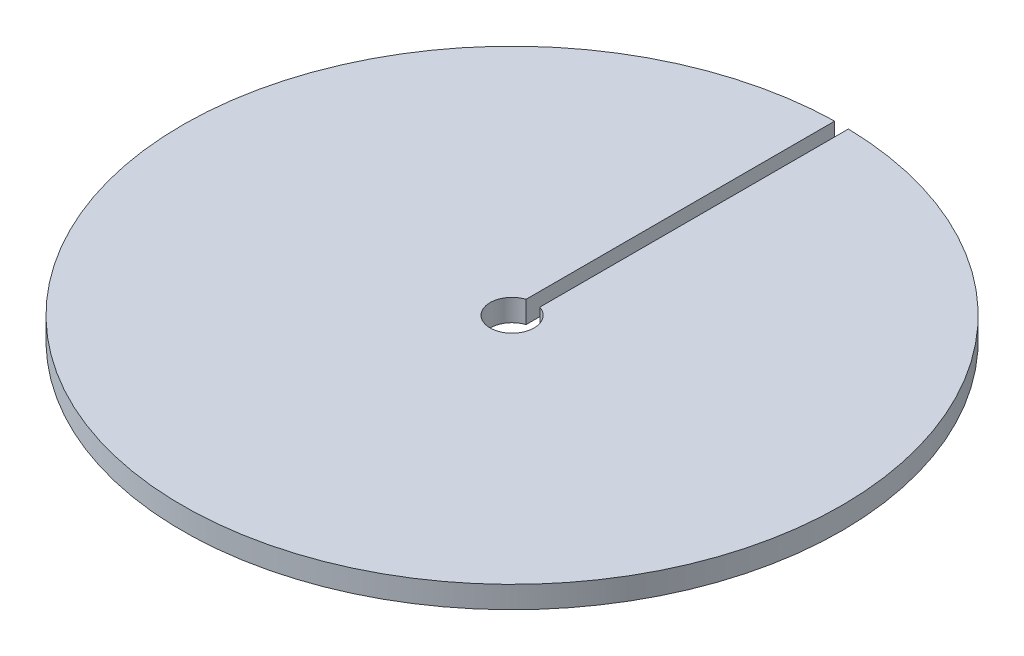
SolidWorks part; units mm, degrees
ref_plane "Front Plane" through (0, 0, 0) normal (0, 0, 1) x (1, 0, 0)
ref_plane "Top Plane" through (0, 0, 0) normal (0, 1, 0) x (1, 0, 0)
ref_plane "Right Plane" through (0, 0, 0) normal (1, 0, 0) x (0, 0, -1)
sketch "Sketch1" plane through (0, 0, 0) normal (0, 1, 0) x (1, 0, 0)
  line L0 (0, 0) -> (0, 95.25) construction
  line L1 (1.9772, 6.0343) -> (1.9772, 95.2295)
  line L2 (-1.9772, 6.0343) -> (-1.9772, 95.2295)
  circle A0 centre (0, 0) radius 95.25
  circle A1 centre (0, 0) radius 6.35
  dimension "D1" = 190.5
  dimension "D2" = 12.7
extrude "Boss-Extrude1" add sketch "Sketch1" along normal blind 6.35 contours A1 L2 A0 L1
